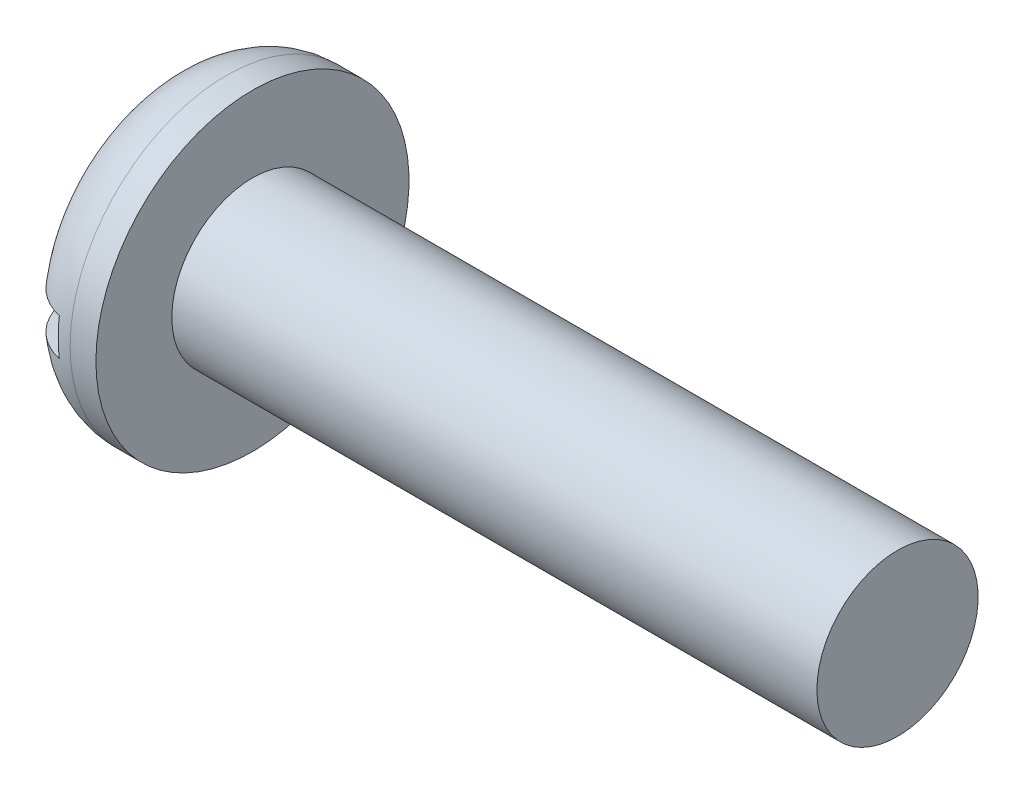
SolidWorks part; units mm, degrees
ref_plane "Plane1" through (0, 0, 0) normal (0, 0, 1) x (1, 0, 0)
ref_plane "Plane2" through (0, 0, 0) normal (0, 1, 0) x (1, 0, 0)
ref_plane "Plane3" through (0, 0, 0) normal (1, 0, 0) x (0, 0, -1)
sketch "BodySke" plane through (0, 0, 0) normal (0, 0, 1) x (1, 0, 0)
  line L0 (5.1562, 4.7625) -> (5.1562, 9.2456)
  line L1 (0, 0) -> (0, 5.6134)
  line L2 (-25.4, 0) -> (127, 0) construction
  line L3 (43.2562, 0) -> (0, 0)
  line L4 (5.1562, 4.7625) -> (43.2562, 4.7625)
  line L5 (43.2562, 4.7625) -> (43.2562, 0)
  line L6 (3.6322, 9.2456) -> (5.1562, 9.2456)
  line L7 (5.1562, -4.7625) -> (43.2562, -4.7625) construction
  line L8 (0, -9.2456) -> (5.1562, -9.2456) construction
  line L9 (6.7437, 6.35) -> (6.7437, -3.175) construction
  line L10 (11.5062, 6.35) -> (11.5062, -3.175) construction
  arc A0 (0, 5.6134) -> (3.6322, 9.2456) centre (3.6322, 5.6134) cw
  point P15 (0, 9.2456)
  dimension "Head_fillet_rad" = 3.6322
  dimension "Head_ht" = 5.1562
  dimension "Diameter" = 9.525
  dimension "Length" = 38.1
  dimension "Head_dia" = 18.4912
  dimension "Advance" = 1.5875
  dimension "Thread_nom" = 31.75
revolve "Base-Revolve" add sketch "BodySke" angle 360 about L2
sketch "Sketch2" plane through (0, 0, 0) normal (1, 0, 0) x (0, 0, -1)
  line L0 (9.2456, -1.1049) -> (-9.2456, -1.1049)
  line L1 (9.2456, -1.1049) -> (9.2456, 1.1049)
  line L2 (-9.2456, 1.1049) -> (9.2456, 1.1049)
  line L3 (-9.2456, 1.1049) -> (-9.2456, -1.1049)
  dimension "D1" = 18.4912
  dimension "D2" = 9.2456
  dimension "Slot_width" = 2.2098
  dimension "D3" = 1.1049
extrude "Slot" cut sketch "Sketch2" along normal blind 2.8448
sketch "ThdSchSke" plane through (0, 0, 0) normal (0, 0, 1) x (1, 0, 0)
  line L0 (11.5062, -3.9688) -> (10.9504, -4.7625)
  line L1 (11.5062, -3.9688) -> (12.062, -4.7625)
  line L2 (12.062, -4.7625) -> (12.062, -5.9531)
  line L3 (-3.175, 0) -> (5.1513, 0) construction
  line L5 (12.062, -5.9531) -> (10.9504, -5.9531)
  line L6 (10.9504, -5.9531) -> (10.9504, -4.7625)
  dimension "Thread_minor" = 7.9375
  dimension "Diameter" = 9.525
  dimension "Start" = 11.5062
  dimension "SideAngle" = 55
  dimension "VeeAngle" = 70
  dimension "Overcut" = 11.9063
revolve "ThreadSchematic" [suppressed] cut sketch "ThdSchSke" angle 360 about L3
pattern_linear "ThdSchPat" [suppressed]
equation "\"D1@Sketch2\" = \"Head_dia@BodySke\""
equation "\"D2@Sketch2\" = \"D1@Sketch2\" / 2"
equation "\"D3@Sketch2\" = \"Slot_width@Sketch2\" / 2"
equation "\"Thread_length@ThreadCosmetic\" = ((sgn( (\"Length@BodySke\" - \"Advance@BodySke\" ) - \"Thread_nom@BodySke\" )-1)*( (\"Length@BodySke\" - \"Advance@BodySke\" ) - \"Thread_nom@BodySke\" ))/-2+ \"Thread_nom@BodySke\""
equation "\"Thread_minor@ThdSchSke\" = \"Thread_minor@ThreadCosmetic\""
equation "\"Diameter@ThdSchSke\" = \"Diameter@BodySke\""
equation "\"Overcut@ThdSchSke\" = \"Diameter@BodySke\" * 1.25"
equation "\"Start@ThdSchSke\" = \"Head_ht@BodySke\" + \"Length@BodySke\" - \"Thread_length@ThreadCosmetic\"  '---Non-countersunk---"
equation "\"Num_threads@ThdSchPat\" = int( \"Thread_length@ThreadCosmetic\" / \"Advance@BodySke\" + 0.999 )  + 1"
equation "\"Advance@ThdSchPat\" = \"Thread_length@ThreadCosmetic\" /  (\"Num_threads@ThdSchPat\" - 1) 'relax it"
